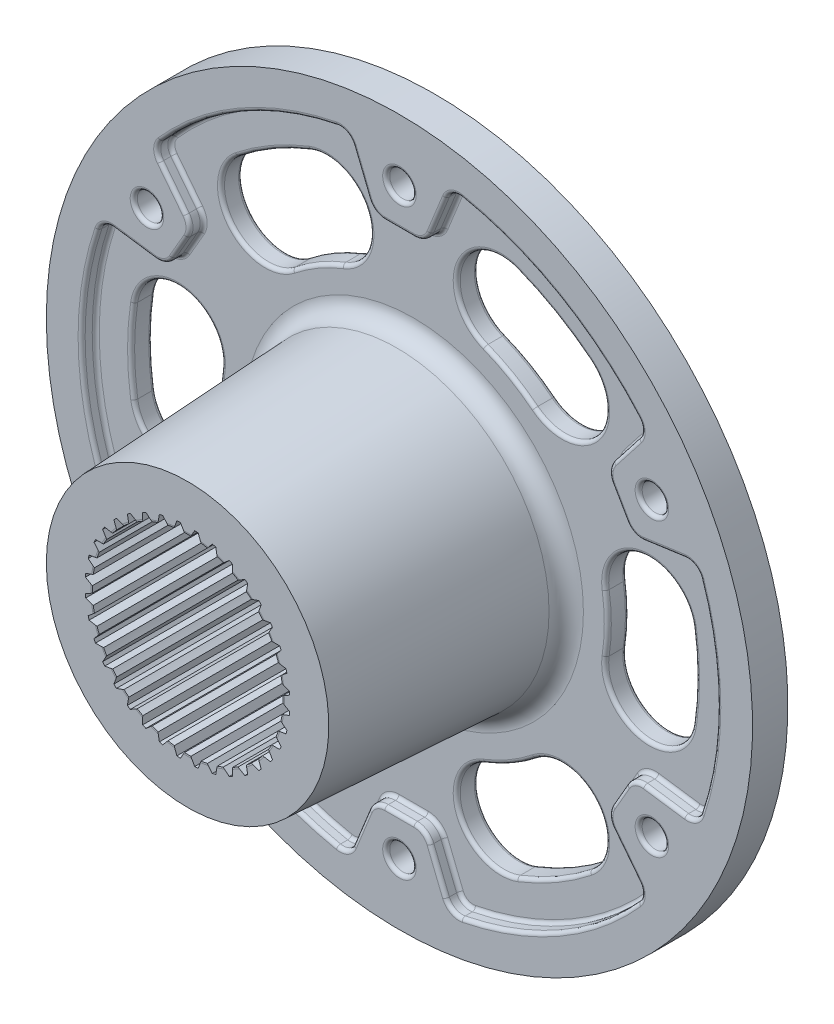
SolidWorks part; units mm, degrees
ref_plane "Front Plane" through (0, 0, 0) normal (0, 0, 1) x (1, 0, 0)
ref_plane "Top Plane" through (0, 0, 0) normal (0, 1, 0) x (1, 0, 0)
ref_plane "Right Plane" through (0, 0, 0) normal (1, 0, 0) x (0, 0, -1)
sketch "Sketch1" plane through (0, 0, 0) normal (1, 0, 0) x (0, 0, -1)
  line L0 (0, 0) -> (-130.4466, 0) construction
  line L1 (0, 0) -> (0, 100)
  line L2 (0, 100) -> (-10, 100)
  line L3 (-10, 100) -> (-10, 90)
  line L4 (-6, 90) -> (-6, 0)
  line L5 (-6, 0) -> (0, 0)
  line L6 (-10, 90) -> (-6, 90)
  dimension "D1" = 180
  dimension "D2" = 200
  dimension "D3" = 6
  dimension "D5" = 10
revolve "Revolve1" add sketch "Sketch1" angle 360 about L0
sketch "Sketch2" plane through (0, 0, 0) normal (0, 0, -1) x (-1, 0, 0)
  circle A0 centre (0, 0) radius 40
  dimension "D1" = 80
extrude "Boss-Extrude1" add sketch "Sketch2" along normal through all draft 3 from offset 70
sketch "Sketch4" plane through (0, 0, 10) normal (0, 0, 1) x (1, 0, 0)
  line L0 (0, 0) -> (0, 100) construction
  line L1 (-14.3825, 88.8434) -> (-8.7634, 74.9356)
  line L2 (14.3825, 88.8434) -> (8.7634, 74.9356)
  line L3 (-4.1275, 71.8086) -> (4.1275, 71.8086)
  arc A1 (-4.1275, 71.8086) -> (-8.7634, 74.9356) centre (-4.1275, 76.8086) cw
  arc A2 (4.1275, 71.8086) -> (8.7634, 74.9356) centre (4.1275, 76.8086) ccw
  arc A3 (14.3825, 88.8434) -> (-14.3825, 88.8434) centre (0, 0) ccw
  circle A4 centre (0, 0) radius 90 construction
  circle A5 centre (0, 0) radius 100 construction
  point P11 (-7.5, 71.8086)
  point P14 (7.5, 71.8086)
  dimension "D3" = 5
  dimension "D1" = 15
  dimension "D2" = 22
  dimension "D4" = 15
extrude "Boss-Extrude3" add sketch "Sketch4" against normal up to next
sketch "Sketch5" plane through (0, 0, 10) normal (0, 0, 1) x (1, 0, 0)
  line L0 (0, 82.55) -> (0, 0) construction
  circle A0 centre (0, 82.55) radius 3.75
  circle A1 centre (0, 0) radius 82.55 construction
  dimension "D1" = 7.5
  dimension "D2" = 165.1
extrude "Cut-Extrude1" cut sketch "Sketch5" against normal through all
pattern_circular "CirPattern2" count 6 over 360 about axis through (0, 0, 0) along (0, 0, 1) of "Boss-Extrude3", "Cut-Extrude1"
sketch "Sketch6" plane through (0, 0, 6) normal (0, 0, 1) x (1, 0, 0)
  line L2 (0, 0) -> (51.6792, 89.511) construction
  line L3 (0, 0) -> (91.0119, 0) construction
  arc A0 (34.253, 43.0317) -> (49.8226, 62.5916) centre (42.0378, 52.8117) ccw
  arc A3 (49.8226, 62.5916) -> (29.2946, 74.4434) centre (0, 0) ccw
  arc A5 (34.253, 43.0317) -> (20.14, 51.1799) centre (0, 0) ccw
  arc A6 (20.14, 51.1799) -> (29.2946, 74.4434) centre (24.7173, 62.8117) cw
  dimension "D4" = 20
  dimension "D2" = 80
  dimension "D3" = 55
  dimension "D1" = 60
extrude "Cut-Extrude2" cut sketch "Sketch6" against normal through all
pattern_circular "CirPattern3" count 6 over 360 about axis through (0, 0, 0) along (0, 0, 1) of "Cut-Extrude2"
sketch "Sketch3" plane through (-8.0116, -2.7849, 70) normal (0, 0, 1) x (1, 0, 0)
  line L0 (8.0116, 2.7849) -> (8.0116, 28.2849) construction
  line L1 (8.0116, 2.7849) -> (33.5116, 2.7849) construction
  circle A0 centre (8.0116, 2.7849) radius 25.5
  circle A1 centre (8.0116, 2.7849) radius 40 construction
  dimension "D1" = 51
extrude "Cut-Extrude11" cut sketch "Sketch3" against normal through all draft 3
fillet "Fillet2" radius 2 1 edges at (25.5, 0, 70)
sketch "Sketch41" plane through (0, 0, 70) normal (0, 0, 1) x (1, 0, 0)
  circle A0 centre (0, 0) radius 27
  circle A1 centre (0, 0) radius 43.3541 construction
  dimension "Inside Diameter" = 54
extrude "Cut-Extrude21" cut sketch "Sketch41" against normal through all
sketch "Sketch51" plane through (0, 0, 70) normal (0, 0, 1) x (1, 0, 0)
  line L0 (0, 0) -> (69.7656, 0) construction
  line L1 (0, 0) -> (0, 47.2389) construction
  line L2 (0, 0) -> (49.3468, 4.3173) construction
  line L3 (26.9848, 0.9066) -> (28.9289, 2.029)
  line L5 (26.7322, 3.793) -> (28.8418, 3.0252)
  arc A1 (26.9848, 0.9066) -> (26.7322, 3.793) centre (0, 0) ccw
  arc A2 (28.8418, 3.0252) -> (28.9289, 2.029) centre (0, 0) cw
  circle A3 centre (0, 0) radius 27 construction
  dimension "D1" = 29
  dimension "D5" = 25
  dimension "D2" = 5
  dimension "D4" = 1
extrude "Cut-Extrude3" cut sketch "Sketch51" against normal through all
pattern_circular "CirPattern1" count 36 over 360 about axis through (0, 0, 0) along (0, 0, 1) of "Cut-Extrude3"
other "36 Spline (Casting)<1>"
fillet "Fillet3" radius 4 12 edges at (-69.7494, 56.8773, 8) (-14.3825, 88.8434, 8) (14.3825, 88.8434, 8) (69.7494, 56.8773, 8) (84.1319, 31.9661, 8) (84.1319, -31.9661, 8) (69.7494, -56.8773, 8) (-14.3825, -88.8434, 8) (-69.7494, -56.8773, 8) (-84.1319, -31.9661, 8) (-84.1319, 31.9661, 8) (14.3825, -88.8434, 8)
fillet "Fillet5" radius 5 1 edges at (43.3541, 0, 6)
fillet "Fillet4" radius 1 156 edges at (-75.0941, 30.6959, 6) (-59.4667, 42.3276, 6) (-62.1881, 35.9043, 6) (-66.3901, 30.3359, 6) (-66.3901, 30.3359, 10) (-62.1881, 35.9043, 10) (-59.4667, 42.3276, 10) (-64.1305, 49.6854, 10) (-69.6154, 44.5226, 0) (-69.6154, 44.5226, 10) (-73.3654, -38.0274, 0) (-73.3654, -38.0274, 10) (-3.75, -82.55, 0) (-3.75, -82.55, 10) (69.6154, -44.5226, 0) (69.6154, -44.5226, 10) (73.3654, 38.0274, 0) (73.3654, 38.0274, 10) (13.0855, 67.3889, 0) (40, 69.282, 0) (51.8178, 45.0269, 0) (27.5, 47.6314, 0) (13.0855, 67.3889, 6) (27.5, 47.6314, 6) (51.8178, 45.0269, 6) (40, 69.282, 6) (-51.8178, 45.0269, 0) (-40, 69.282, 0) (-13.0855, 67.3889, 0) (-27.5, 47.6314, 0) (-51.8178, 45.0269, 6) (-27.5, 47.6314, 6) (-13.0855, 67.3889, 6) (-40, 69.282, 6) (-64.9033, -22.3621, 0) (-80, 0, 0) (-64.9033, 22.3621, 0) (-55, 0, 0) (-64.9033, -22.3621, 6) (-55, 0, 6) (-64.9033, 22.3621, 6) (-80, 0, 6) (-13.0855, -67.3889, 0) (-40, -69.282, 0) (-51.8178, -45.0269, 0) (-27.5, -47.6314, 0) (-13.0855, -67.3889, 6) (-27.5, -47.6314, 6) (-51.8178, -45.0269, 6) (-40, -69.282, 6) (51.8178, -45.0269, 0) (40, -69.282, 0) (13.0855, -67.3889, 0) (27.5, -47.6314, 0) (51.8178, -45.0269, 6) (27.5, -47.6314, 6) (13.0855, -67.3889, 6) (40, -69.282, 6) (64.9033, 22.3621, 0) (80, 0, 0) (64.9033, -22.3621, 0) (55, 0, 0) (64.9033, 22.3621, 6) (55, 0, 6) (64.9033, -22.3621, 6) (80, 0, 6) (-10.9636, 80.3813, 6) (6.9234, 72.6635, 6) (0, 71.8086, 6) (-6.9234, 72.6635, 6) (-6.9234, 72.6635, 10) (0, 71.8086, 10) (6.9234, 72.6635, 10) (10.9636, 80.3813, 10) (3.75, 82.55, 0) (3.75, 82.55, 10) (64.1305, 49.6854, 6) (66.3901, 30.3359, 6) (62.1881, 35.9043, 6) (59.4667, 42.3276, 6) (59.4667, 42.3276, 10) (62.1881, 35.9043, 10) (66.3901, 30.3359, 10) (75.0941, 30.6959, 10) (75.0941, -30.6959, 6) (59.4667, -42.3276, 6) (62.1881, -35.9043, 6) (66.3901, -30.3359, 6) (66.3901, -30.3359, 10) (62.1881, -35.9043, 10) (59.4667, -42.3276, 10) (64.1305, -49.6854, 10) (10.9636, -80.3813, 6) (-6.9234, -72.6635, 6) (0, -71.8086, 6) (6.9234, -72.6635, 6) (6.9234, -72.6635, 10) (0, -71.8086, 10) (-6.9234, -72.6635, 10) (-10.9636, -80.3813, 10) (-64.1305, 49.6854, 6) (-45, 77.9423, 6) (-45, 77.9423, 10) (-90, 0, 6) (-75.0941, -30.6959, 6) (-45, -77.9423, 6) (-10.9636, -80.3813, 6) (45, -77.9423, 6) (64.1305, -49.6854, 6) (90, 0, 6) (75.0941, 30.6959, 6) (45, 77.9423, 6) (10.9636, 80.3813, 6) (14.9736, -87.8491, 6) (-83.5663, 30.9571, 6) (-83.5663, -30.9571, 6) (-68.5928, -56.892, 6) (-14.9736, -87.8491, 6) (68.5928, -56.892, 6) (83.5663, -30.9571, 6) (83.5663, 30.9571, 6) (68.5928, 56.892, 6) (14.9736, 87.8491, 6) (-14.9736, 87.8491, 6) (-68.5928, 56.892, 6) (-10.9636, 80.3813, 10) (45, 77.9423, 10) (-64.1305, -49.6854, 6) (64.1305, 49.6854, 10) (90, 0, 10) (-66.3901, -30.3359, 6) (-62.1881, -35.9043, 6) (75.0941, -30.6959, 10) (-59.4667, -42.3276, 6) (45, -77.9423, 10) (-45, -77.9423, 10) (-64.1305, -49.6854, 10) (-90, 0, 10) (-75.0941, 30.6959, 10) (10.9636, -80.3813, 10) (-68.5928, 56.892, 10) (-14.9736, 87.8491, 10) (14.9736, 87.8491, 10) (-59.4667, -42.3276, 10) (68.5928, 56.892, 10) (83.5663, 30.9571, 10) (-62.1881, -35.9043, 10) (83.5663, -30.9571, 10) (68.5928, -56.892, 10) (-14.9736, -87.8491, 10) (-66.3901, -30.3359, 10) (-68.5928, -56.892, 10) (-83.5663, -30.9571, 10) (-83.5663, 30.9571, 10) (-75.0941, -30.6959, 10) (14.9736, -87.8491, 10)
